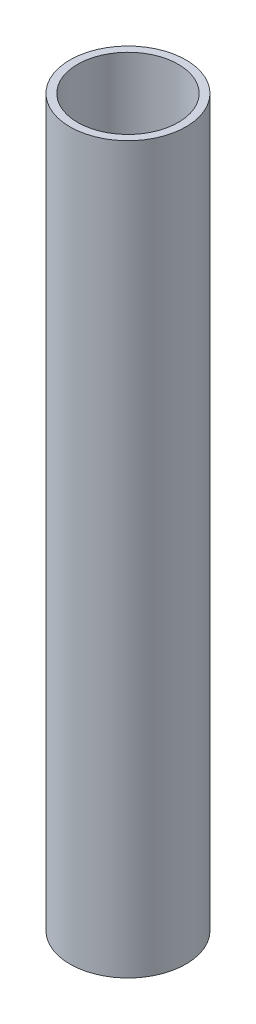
SolidWorks part; units mm, degrees
ref_plane "Plan de face" through (0, 0, 0) normal (0, 0, 1) x (1, 0, 0)
ref_plane "Plan de dessus" through (0, 0, 0) normal (0, 1, 0) x (1, 0, 0)
ref_plane "Plan de droite" through (0, 0, 0) normal (1, 0, 0) x (0, 0, -1)
sketch "Esquisse1" plane through (0, 0, 0) normal (0, 1, 0) x (1, 0, 0)
  circle A0 centre (0, 0) radius 15.2
  circle A1 centre (0, 0) radius 13.2
  dimension "D1" = 30.4
  dimension "D2" = 26.4
extrude "Extrusion1" add sketch "Esquisse1" along normal blind 190
